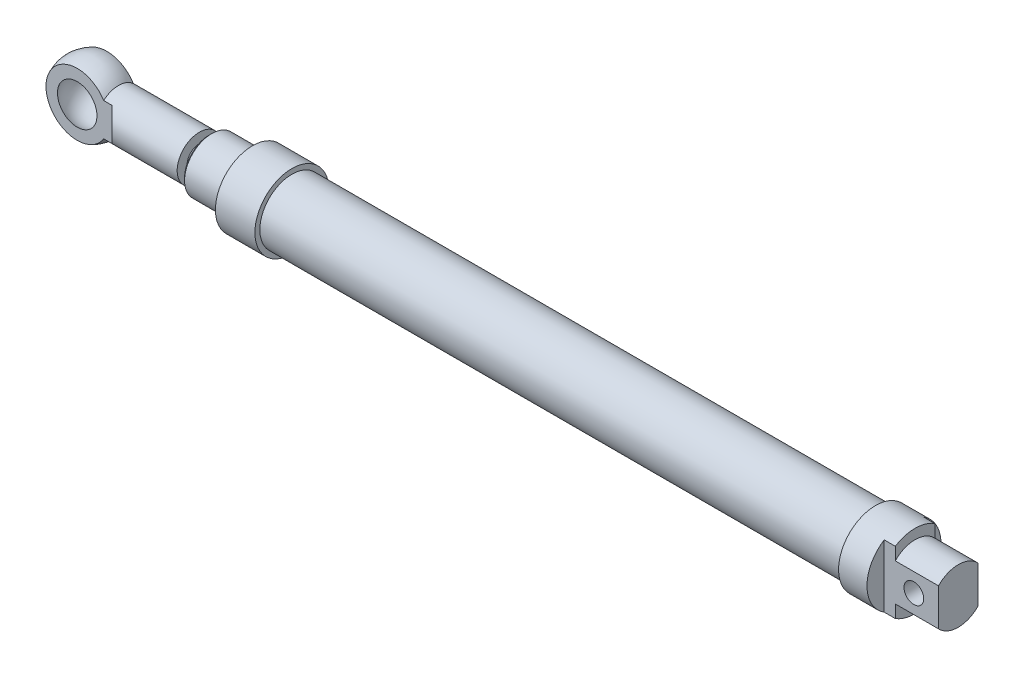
SolidWorks part; units mm, degrees
ref_plane "Face" through (0, 0, 0) normal (0, 0, 1) x (1, 0, 0)
ref_plane "Dessus" through (0, 0, 0) normal (0, 1, 0) x (1, 0, 0)
ref_plane "Droite" through (0, 0, 0) normal (1, 0, 0) x (0, 0, -1)
sketch "Esquisse1" plane through (0, 0, 0) normal (0, 0, 1) x (1, 0, 0)
  line L0 (-97.004, 0) -> (95.1168, 0) construction
  line L1 (0, 5) -> (0, 11)
  line L2 (0, 11) -> (17.5, 11)
  line L3 (17.5, 11) -> (17.5, 15)
  line L4 (17.5, 15) -> (33.5, 15)
  line L5 (33.5, 15) -> (33.5, 13)
  line L6 (33.5, 13) -> (270, 13)
  line L7 (270, 13) -> (270, 15)
  line L8 (270, 15) -> (286, 15)
  line L10 (0, 5) -> (-4.5, 5)
  line L11 (-4.5, 5) -> (-4.5, 0)
  line L12 (303.5, 0) -> (-4.5, 0)
  line L14 (286, 15) -> (286, 11)
  line L15 (286, 11) -> (303.5, 11)
  line L16 (303.5, 11) -> (303.5, 0)
  dimension "D1" = 10
  dimension "D2" = 22
  dimension "D3" = 30
  dimension "D4" = 26
  dimension "D5" = 11
  dimension "D6" = 16
  dimension "D7" = 17.5
  dimension "D8" = 236.5
  dimension "D9" = 4.5
  dimension "D10" = 17.5
  dimension "D11" = 33.5
revolve "Révolution1" add sketch "Esquisse1" angle 360 about L12
sketch "Esquisse2" plane through (0, 0, 0) normal (0, 1, 0) x (1, 0, 0)
  line L0 (303.5, 0) -> (260.4523, 0) construction
  line L1 (281.5, 18.8959) -> (305.7924, 18.8959)
  line L2 (281.5, 18.8959) -> (281.5, 8)
  line L3 (281.5, 8) -> (305.7924, 8)
  line L4 (305.7924, 18.8959) -> (305.7924, 8)
  line L5 (305.7924, -18.8959) -> (305.7924, -8)
  line L6 (281.5, -8) -> (305.7924, -8)
  line L7 (281.5, -18.8959) -> (281.5, -8)
  line L8 (281.5, -18.8959) -> (305.7924, -18.8959)
  line L9 (303.5, -11) -> (303.5, 11) construction
  dimension "D1" = 8
  dimension "D3" = 22
extrude "Enlèv. mat.-Extru.1" cut sketch "Esquisse2" against normal mid plane 30
sketch "Esquisse3" plane through (0, 0, 8) normal (0, 0, 1) x (1, 0, 0)
  line L0 (303.5, -7.5498) -> (303.5, 7.5498) construction
  circle A0 centre (293.5, 0) radius 4
  dimension "D1" = 8
  dimension "D2" = 10
extrude "Enlèv. mat.-Extru.2" cut sketch "Esquisse3" against normal through all
sketch "Esquisse4" plane through (0, 0, 0) normal (0, 0, 1) x (1, 0, 0)
  line L0 (-199.4149, 0) -> (-244.0603, 0) construction
  line L2 (-36.7762, 9) -> (-4, 9)
  line L3 (-4.5, 5) -> (-4.5, -5) construction
  line L5 (-4, 9) -> (-4, 0)
  line L6 (-4, 0) -> (-61.5, 0)
  arc A0 (-36.7762, 9) -> (-61.5, 0) centre (-47.5, 0) ccw
  dimension "D4" = 28
  dimension "D2" = 43
  dimension "D3" = 9
  dimension "D5" = 0.5
revolve "Révolution3" add sketch "Esquisse4" angle 360 about L0
sketch "Esquisse5" plane through (0, 0, 0) normal (0, 1, 0) x (1, 0, 0)
  line L0 (-231.5883, 0) -> (-280.354, 0) construction
  line L1 (-277.5495, 6) -> (-33.4, 6)
  line L2 (-33.4, 6) -> (-16.2617, 23.1383)
  line L3 (-16.2617, 23.1383) -> (-16.2617, 78.2582)
  line L4 (-16.2617, 78.2582) -> (-277.5495, 16.8947)
  line L5 (-277.5495, 16.8947) -> (-277.5495, 6)
  line L6 (-277.5495, -16.8947) -> (-277.5495, -6)
  line L7 (-16.2617, -78.2582) -> (-277.5495, -16.8947)
  line L8 (-16.2617, -23.1383) -> (-16.2617, -78.2582)
  line L9 (-33.4, -6) -> (-16.2617, -23.1383)
  line L10 (-277.5495, -6) -> (-33.4, -6)
  arc A0 (-36.7762, 9) -> (-36.7762, -9) centre (-47.5, 0) ccw construction
  dimension "D3" = 28.1
  dimension "D1" = 135
  dimension "D2" = 6
extrude "Enlèv. mat.-Extru.3" cut sketch "Esquisse5" against normal mid plane 30
sketch "Esquisse6" plane through (0, 0, 0) normal (0, 0, 1) x (1, 0, 0)
  line L0 (-244.9874, 0) -> (-275.8779, 0) construction
  line L1 (-57.5, 0) -> (-37.5, 0)
  arc A0 (-37.5, 0) -> (-57.5, 0) centre (-47.5, 0) ccw
  arc A1 (-36.7762, 9) -> (-36.7762, -9) centre (-47.5, 0) ccw construction
  dimension "D1" = 20
revolve "Enlèvement de matière-Révolution1" cut sketch "Esquisse6" angle 360 about L0
chamfer "Chanfrein1" distance 1 angle 45 1 edges at (0, 11, 0)
